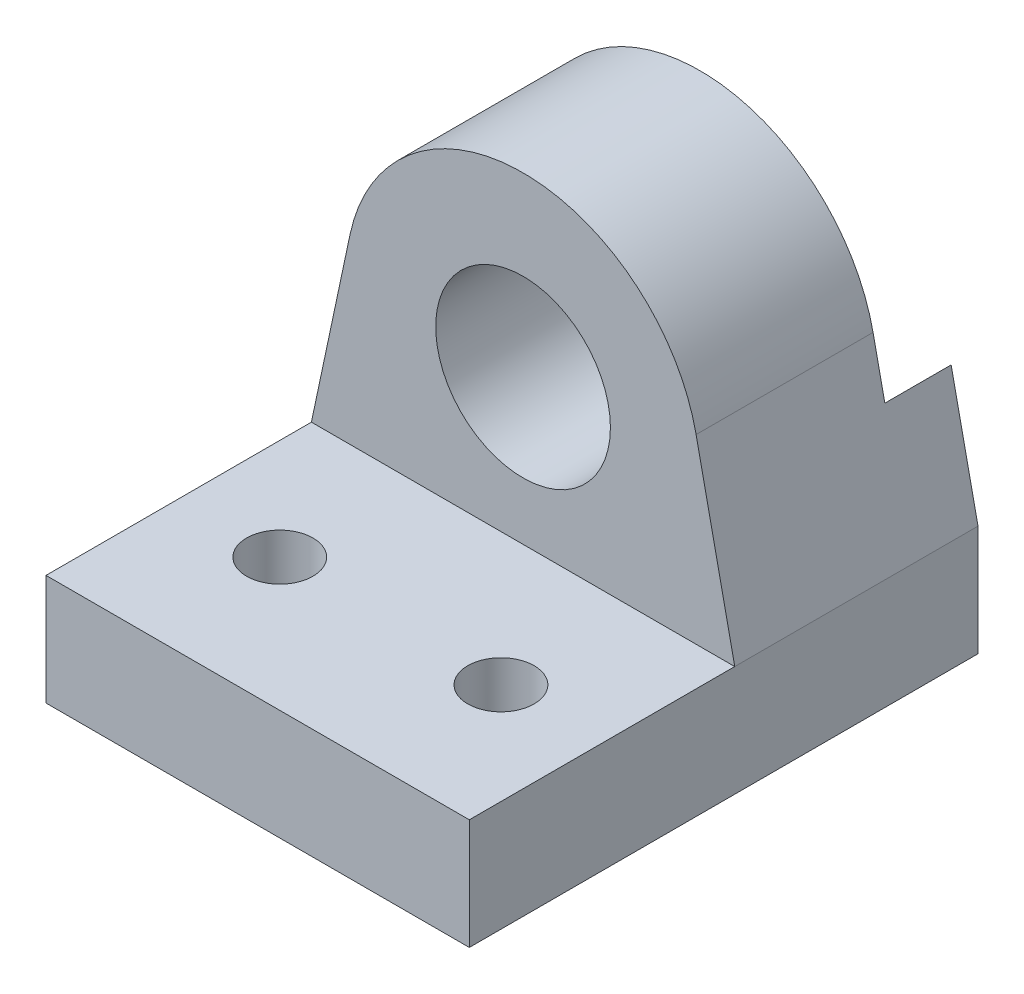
SolidWorks part; units mm, degrees
ref_plane "前视基准面" through (0, 0, 0) normal (0, 0, 1) x (1, 0, 0)
ref_plane "上视基准面" through (0, 0, 0) normal (0, 1, 0) x (1, 0, 0)
ref_plane "右视基准面" through (0, 0, 0) normal (1, 0, 0) x (0, 0, -1)
sketch "草图1" plane through (0, 0, 0) normal (0, 0, 1) x (1, 0, 0)
  line L0 (0, 0) -> (0, -6.55) construction
  line L1 (9.5704, -6.55) -> (-9.5704, -6.55)
  line L2 (-9.5704, -6.55) -> (-7.8253, 1.6628)
  line L3 (9.5704, -6.55) -> (7.8253, 1.6628)
  circle A0 centre (0, 0) radius 3.95
  arc A1 (7.8253, 1.6628) -> (-7.8253, 1.6628) centre (0, 0) ccw
  dimension "D1" = 16
  dimension "D2" = 7.9
  dimension "D3" = 6.55
extrude "凸台-拉伸1" add sketch "草图1" along normal blind 8
sketch "草图3" plane through (0, -6.55, 0) normal (0, -1, 0) x (1, 0, 0)
  line L0 (9.5704, 8) -> (9.5704, 0) construction
  line L1 (-9.5704, 0) -> (9.5704, 0)
  line L2 (-9.5704, 0) -> (-9.5704, 20)
  line L3 (-9.5704, 20) -> (9.5704, 20)
  line L4 (9.5704, 0) -> (9.5704, 20)
  dimension "D1" = 20
extrude "凸台-拉伸2" add sketch "草图3" along normal blind 5
sketch "草图4" plane through (0, -6.55, 0) normal (0, 1, 0) x (1, 0, 0)
  line L0 (0, -20) -> (0, -8) construction
  line L1 (9.5704, -20) -> (-9.5704, -20) construction
  line L2 (-7.8253, -8) -> (7.8253, -8) construction
  circle A0 centre (-5, -14) radius 1.5
  circle A1 centre (5, -14) radius 1.5
  dimension "D1" = 5
extrude "切除-拉伸1" cut sketch "草图4" against normal blind 8
sketch "草图6" plane through (0, 0, 0) normal (0, 0, -1) x (-1, 0, 0)
  line L3 (0, -11.55) -> (-9.5704, -11.55)
  line L4 (9.5704, -11.55) -> (-9.5704, -11.55) construction
  line L5 (0, -11.55) -> (0, -8)
  line L7 (-9.5704, -6.55) -> (-9.5704, -11.55)
  line L8 (-8.3576, -0.8422) -> (-9.5704, -6.55)
  line L9 (-7.3362, -3.1906) -> (-8.3576, -0.8422)
  arc A0 (-7.3362, -3.1906) -> (0, -8) centre (0, 0) ccw
  dimension "D1" = 16
extrude "凸台-拉伸3" add sketch "草图6" along normal blind 3
